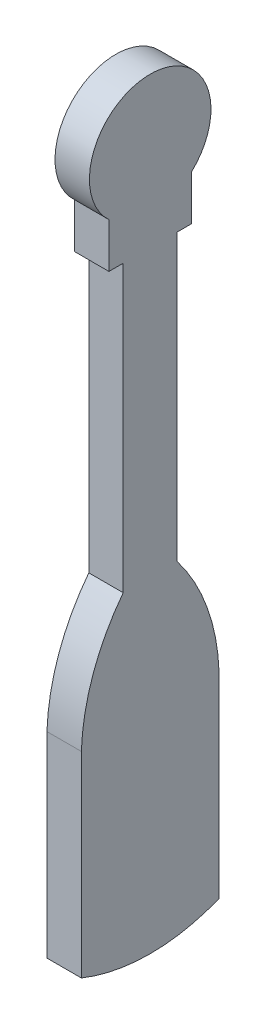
SolidWorks part; units mm, degrees
ref_plane "Alzado" through (0, 0, 0) normal (0, 0, 1) x (1, 0, 0)
ref_plane "Planta" through (0, 0, 0) normal (0, 1, 0) x (1, 0, 0)
ref_plane "Vista lateral" through (0, 0, 0) normal (1, 0, 0) x (0, 0, -1)
sketch "Croquis1" plane through (0, 0, 0) normal (1, 0, 0) x (0, 0, -1)
  line L0 (12788.2636, 4836.4637) -> (12788.2636, 4816.8971)
  line L1 (12794.4817, 4816.8971) -> (12794.4817, 4692.533)
  line L2 (12788.2636, 4816.8971) -> (12794.4817, 4816.8971)
  line L3 (12776.249, 4641.7562) -> (12776.249, 4556.2509)
  line L4 (12836.249, 4641.7562) -> (12836.249, 4556.2509)
  line L5 (12824.2344, 4836.4637) -> (12824.2344, 4816.8971)
  line L6 (12818.0163, 4816.8971) -> (12818.0163, 4692.533)
  line L7 (12824.2344, 4816.8971) -> (12818.0163, 4816.8971)
  arc A0 (12824.2344, 4836.4637) -> (12788.2636, 4836.4637) centre (12806.249, 4855.8985) ccw
  arc A1 (12776.249, 4556.2509) -> (12836.249, 4556.2509) centre (12806.249, 4630.2541) ccw
  arc A2 (12794.4817, 4692.533) -> (12776.249, 4641.7562) centre (12864.6207, 4638.6859) ccw
  arc A3 (12836.249, 4641.7562) -> (12818.0163, 4692.533) centre (12747.8774, 4638.6859) ccw
extrude "Saliente-Extruir1" add sketch "Croquis1" along normal blind 15
